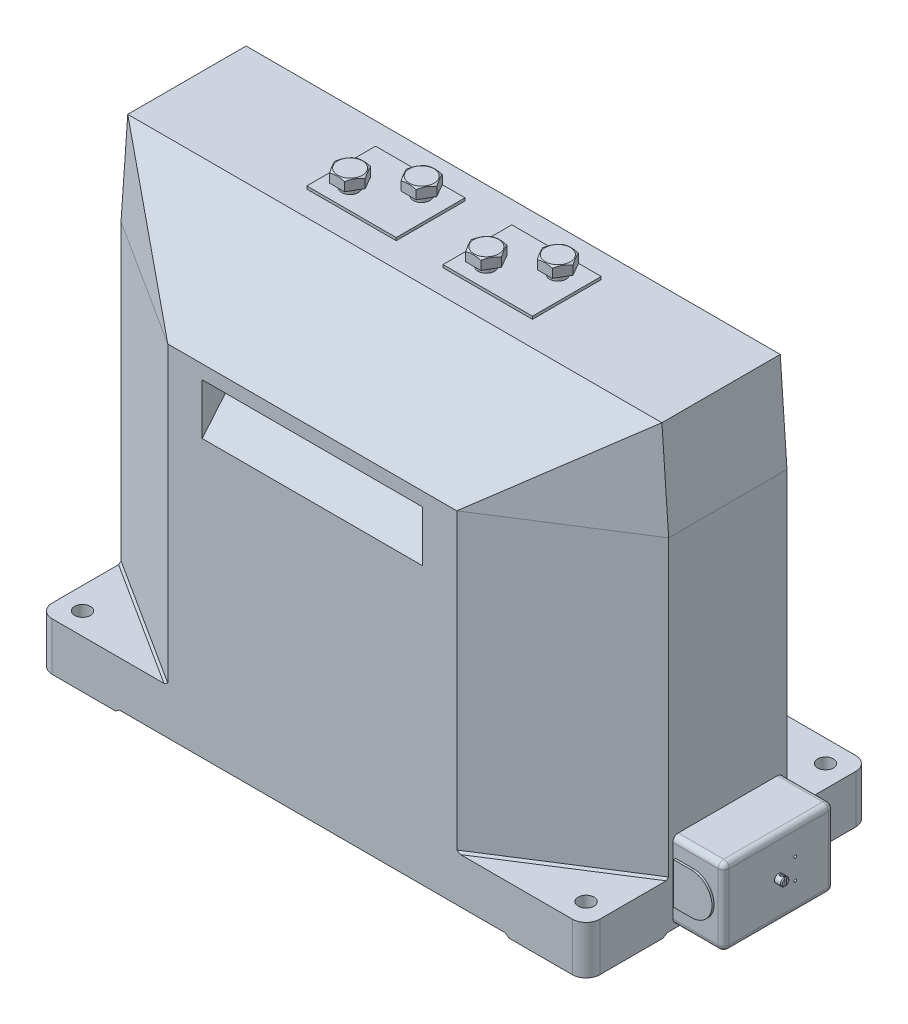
SolidWorks part; units mm, degrees
ref_plane "Front Plane" through (0, 0, 0) normal (0, 0, 1) x (1, 0, 0)
ref_plane "Top Plane" through (0, 0, 0) normal (0, 1, 0) x (1, 0, 0)
ref_plane "Right Plane" through (0, 0, 0) normal (1, 0, 0) x (0, 0, -1)
other "Join1"
other "21105-115_PlombaCsavar<1>@24305_AM-40b_Körvonalrajzhoz"
other "HlTmCsDIN933<4>@24305_AM-40b_Körvonalrajzhoz"
other "HlTmCsDIN933<2>@24305_AM-40b_Körvonalrajzhoz"
other "AM40b_TRA_Kiöntött_Körvonalrajzhoz<1>@24305_AM-40b_Körvonalrajzhoz/AM40b_TRA_Test_T24305<1>@AM40b_TRA_Kiöntött_Körvonalrajzhoz"
other "HlTmCsDIN933<1>@24305_AM-40b_Körvonalrajzhoz"
other "FME12_Tömszelence_29519_112<1>@24305_AM-40b_Körvonalrajzhoz"
other "FME12_TRA_Kapocsfedél_29519_113<1>@24305_AM-40b_Körvonalrajzhoz"
other "FME12_Tömszelence_29519_112<2>@24305_AM-40b_Körvonalrajzhoz"
other "HlTmCsDIN933<5>@24305_AM-40b_Körvonalrajzhoz"
other "HlTmCsDIN933<3>@24305_AM-40b_Körvonalrajzhoz"
